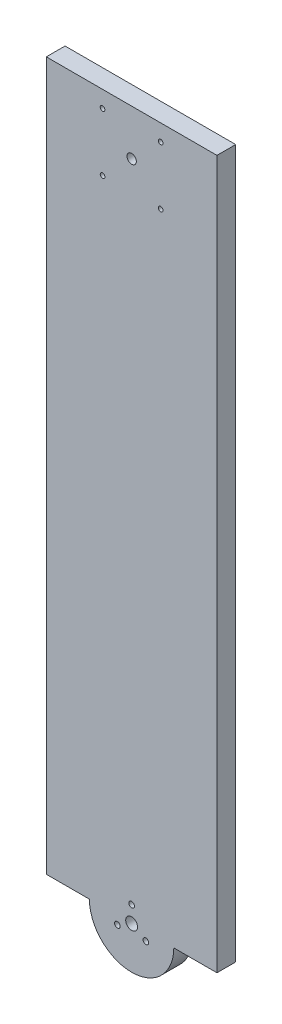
SolidWorks part; units mm, degrees
ref_plane "Front Plane" through (0, 0, 0) normal (0, 0, 1) x (1, 0, 0)
ref_plane "Top Plane" through (0, 0, 0) normal (0, 1, 0) x (1, 0, 0)
ref_plane "Right Plane" through (0, 0, 0) normal (1, 0, 0) x (0, 0, -1)
sketch "Sketch1" plane through (0, 0, 0) normal (0, 0, 1) x (1, 0, 0)
  line L0 (0, -1565.9861) -> (0, 76733.3209) construction
  line L1 (-22.5, 130) -> (22.5, 130)
  line L2 (-22.5, 130) -> (-22.5, -247.5)
  line L4 (22.5, 130) -> (22.5, -247.5)
  line L5 (-22.5, 130) -> (29.4093, -169.9204) construction
  line L6 (-22.5, -130) -> (22.5, 130) construction
  line L7 (-1565.9861, 0) -> (76733.3209, 0) construction
  line L8 (-42.7696, 105.6639) -> (42.7696, 105.6639) construction
  line L9 (-21.1, 126.7639) -> (21.1, 126.7639) construction
  line L10 (-21.1, 126.7639) -> (-21.1, 84.5639) construction
  line L11 (-21.1, 84.5639) -> (21.1, 84.5639) construction
  line L12 (21.1, 126.7639) -> (21.1, 84.5639) construction
  line L13 (-21.1, 126.7639) -> (21.1, 84.5639) construction
  line L14 (-21.1, 84.5639) -> (21.1, 126.7639) construction
  circle A0 centre (-15.5, 121.1639) radius 1.25
  circle A1 centre (15.5, 121.1639) radius 1.25
  circle A2 centre (15.5, 90.1639) radius 1.25
  circle A3 centre (-15.5, 90.1639) radius 1.25
  circle A4 centre (0, 105.6639) radius 2.5
  circle A5 centre (0, -247.5) radius 8.75 construction
  arc A6 (-22.5, -247.5) -> (22.5, -247.5) centre (0, -247.5) ccw
  circle A7 centre (0, -238.75) radius 1.5
  circle A10 centre (0, -247.5) radius 3.15
  circle A11 centre (7.5777, -251.875) radius 1.5
  circle A12 centre (-7.5777, -251.875) radius 1.5
  point P0 (0, 0)
  point P9 (0, 105.6639)
  point P20 (0, 105.6639)
  point P28 (0, 83.0234)
  point P40 (0, -270)
  point P43 (0, -247.5)
  point P46 (0, -107.5)
  point P49 (0, -147.5)
  dimension "D4" = 2.5
  dimension "D6" = 5
  dimension "D9" = 17.5
  dimension "D10" = 3
  dimension "D12" = 6.3
  dimension "D1" = 45
  dimension "D2" = 400
  dimension "D3" = 42.2
  dimension "D5" = 31
  dimension "D7" = 3
extrude "Boss-Extrude1" add sketch "Sketch1" along normal blind 10
sketch "Sketch2" plane through (22.5, 0, 0) normal (1, 0, 0) x (0, 0, -1)
  line L1 (-10, 130) -> (0, 130)
  line L2 (-10, 130) -> (-10, -247.5)
  line L3 (-10, -247.5) -> (0, -247.5)
  line L4 (0, 130) -> (0, -247.5)
extrude "Boss-Extrude2" add sketch "Sketch2" along normal blind 23
sketch "Sketch3" plane through (-22.5, 0, 0) normal (-1, 0, 0) x (0, 0, 1)
  line L1 (0, 130) -> (10, 130)
  line L2 (0, 130) -> (0, -247.5)
  line L3 (0, -247.5) -> (10, -247.5)
  line L4 (10, 130) -> (10, -247.5)
extrude "Boss-Extrude3" add sketch "Sketch3" along normal blind 23
